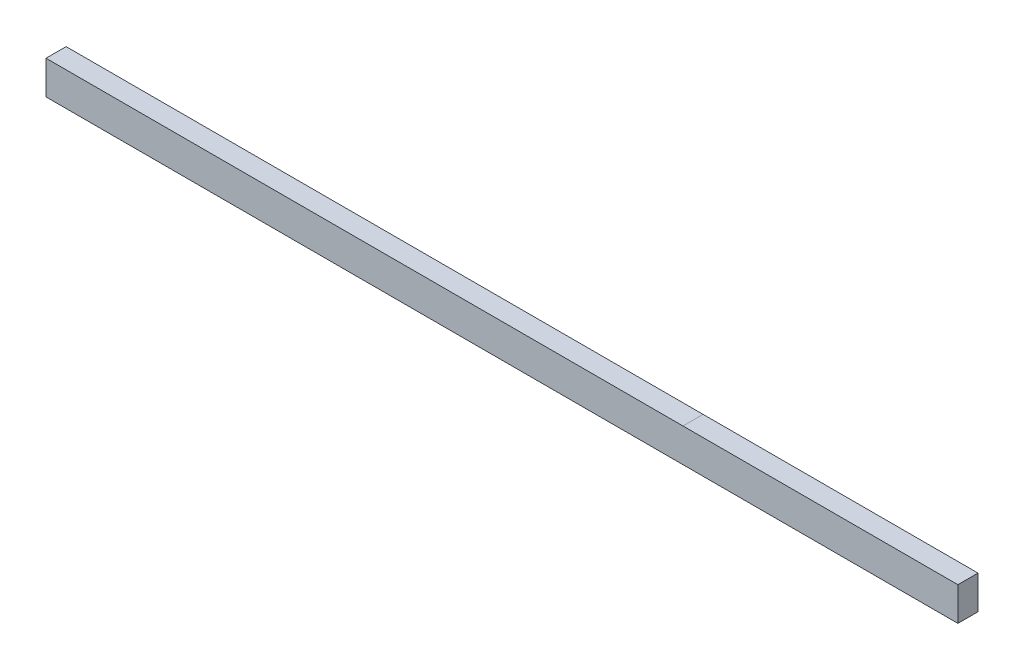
SolidWorks part; units mm, degrees
ref_plane "Front Plane" through (0, 0, 0) normal (0, 0, 1) x (1, 0, 0)
ref_plane "Top Plane" through (0, 0, 0) normal (0, 1, 0) x (1, 0, 0)
ref_plane "Right Plane" through (0, 0, 0) normal (1, 0, 0) x (0, 0, -1)
sketch "Sketch1" plane through (0, 0, 0) normal (1, 0, 0) x (0, 0, -1)
  line L1 (-7.5, 12.5) -> (7.5, 12.5)
  line L2 (-7.5, 12.5) -> (-7.5, -12.5)
  line L3 (-7.5, -12.5) -> (7.5, -12.5)
  line L4 (7.5, 12.5) -> (7.5, -12.5)
  dimension "D1" = 25
  dimension "D2" = 15
  dimension "D3" = 12.5
  dimension "D4" = 7.5
extrude "Extrude1" add sketch "Sketch1" along normal blind 680
ref_plane "Plane1" through (0, 20, 0) normal (0, 1, 0) x (-1, 0, 0)
sketch "Sketch2" plane through (0, 20, 0) normal (0, 1, 0) x (-1, 0, 0)
  line L0 (-475, -69.8364) -> (-475, 76.7623)
  dimension "D1" = 475
sketch "Sketch3" plane through (0, 0, 0) normal (0, 1, 0) x (1, 0, 0)
  line L0 (600, 51.3673) -> (600, -61.7562)
  dimension "D1" = 600
